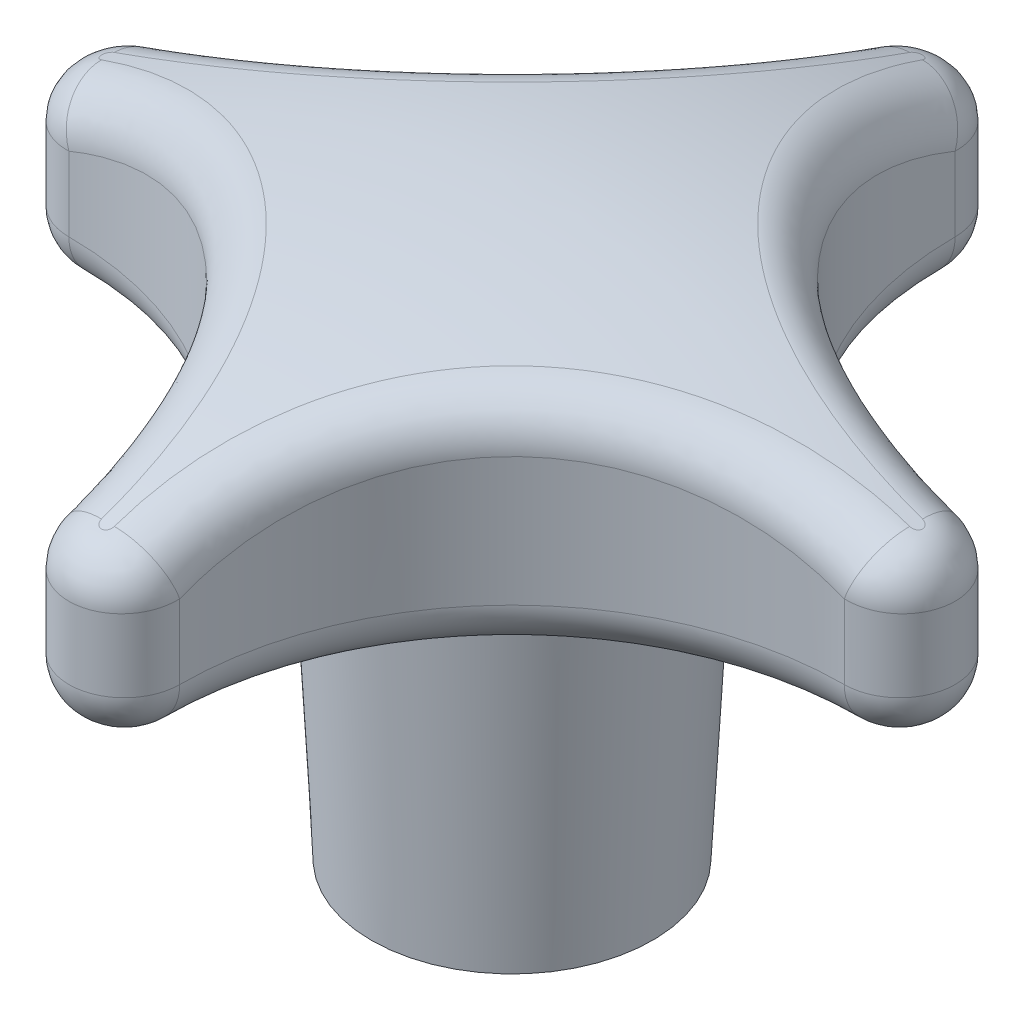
SolidWorks part; units mm, degrees
ref_plane "Front Plane" through (0, 0, 0) normal (0, 0, 1) x (1, 0, 0)
ref_plane "Top Plane" through (0, 0, 0) normal (0, 1, 0) x (1, 0, 0)
ref_plane "Right Plane" through (0, 0, 0) normal (1, 0, 0) x (0, 0, -1)
sketch "Sketch1" plane through (0, 0, 0) normal (0, 1, 0) x (1, 0, 0)
  circle A0 centre (0, 0) radius 10
  dimension "D1" = 20
extrude "Extrude1" add sketch "Sketch1" against normal blind 23
draft "Draft1" type of draft neutral plane draft angle 3 faces to draft 1 parameters "D1"=3
sketch "Sketch2" plane through (0, 0, 0) normal (0, 0, 1) x (1, 0, 0)
  line L0 (0, 0) -> (-31.5, 0)
  line L1 (-31.5, 0) -> (-31.5, 11.05)
  line L2 (0, 0) -> (0, 50000) construction
  line L3 (0, 17) -> (20.2547, 17) construction
  line L4 (0, 0) -> (0, 17)
  arc A0 (0, 17) -> (-31.5, 11.05) centre (0, -69.3574) ccw
revolve "Revolve1" add sketch "Sketch2" angle 360 about L2
sketch "Sketch4" plane through (0, 0, 0) normal (0, 1, 0) x (1, 0, 0)
  line L0 (0, 0) -> (-50000, 0) construction
  line L1 (0, 0) -> (0, 50000) construction
  line L2 (-27.5625, 3.9375) -> (-45.9117, 3.9375) construction
  line L3 (-3.9375, 27.5625) -> (-3.9375, 40.3224) construction
  arc A0 (0, 31.5) -> (-3.9375, 27.5625) centre (0, 27.5625) ccw
  arc A1 (-27.5625, 3.9375) -> (-31.5, 0) centre (-27.5625, 0) ccw
  circle A2 centre (0, 0) radius 31.5 construction
  arc A3 (-27.5625, 3.9375) -> (-3.9375, 27.5625) centre (-27.5625, 27.5625) ccw
  arc A4 (0, 31.5) -> (-31.5, 0) centre (-31.5, 31.5) ccw
  point P9 (0, 31.5)
  point P10 (-31.5, 0)
  point P13 (-3.9375, 27.5625)
  point P14 (-27.5625, 3.9375)
extrude "Extrude3" cut sketch "Sketch4" along normal through all
pattern_circular "CirPattern1" count 4 over 360 about axis through (0, 0, 0) along (0, 1, 0) of "Extrude3"
fillet "Fillet2" radius 3.5 16 edges at (0, 0, 31.5) (10.8571, 0, 10.8571) (31.5, 0, 0) (10.8571, 0, -10.8571) (0, 0, -31.5) (-10.8571, 0, -10.8571) (-31.5, 0, 0) (-0.0002, 11.05, 31.5) (13.307, 15.5215, 8.7232) (31.5, 11.05, 0.0002) (8.7232, 15.5215, -13.307) (0.0002, 11.05, -31.5) (-13.307, 15.5215, -8.7232) (-31.5, 11.05, 0.0002) (-10.8571, 0, 10.8571) (-8.7232, 15.5215, 13.307)
sketch "Sketch6" plane through (0, -23, 0) normal (0, -1, 0) x (1, 0, 0)
  circle A0 centre (0, 0) radius 6
  dimension "D1" = 12
extrude "Extrude5" [suppressed] cut sketch "Sketch6" against normal blind 25
sketch "Sketch7" [suppressed] plane through (0, 0, 0) normal (0, 0, 1) x (1, 0, 0)
  line L0 (-0.125, 1) -> (5, 1)
  line L1 (5, -20) -> (5, 1) construction
  line L2 (5, 1) -> (-0.125, 3.9589)
  line L3 (-0.125, 3.9589) -> (-0.125, 1)
  line L4 (-5, -20) -> (5, -20) construction
revolve "Cut-Revolve1" [suppressed] cut sketch "Sketch7" angle 360 about L3
sketch "Sketch10" plane through (0, -23, 0) normal (0, -1, 0) x (1, 0, 0)
  circle A0 centre (0, 0) radius 5.1
  dimension "D1" = 10.2
extrude "Extrude8" cut sketch "Sketch10" against normal blind 25
sketch "Sketch11" plane through (0, 0, 0) normal (0, 0, 1) x (1, 0, 0)
  line L0 (0, 2) -> (5.1, 2)
  line L1 (-5.1, 2) -> (5.1, 2) construction
  line L2 (5.1, 2) -> (0, 4.9445)
  line L3 (0, 4.9445) -> (0, 2)
  dimension "D1" = 30
revolve "Cut-Revolve2" cut sketch "Sketch11" angle 360 about L3
equation "\"D2@Sketch2\" = \"D1@Sketch2\"*.65"
equation "\"D1@Sketch4\" = (\"D3@Sketch2\"*2)/8"
equation "\"D2@Sketch4\" =( \"D3@Sketch2\"*2)/8"
equation "\"D1@Sketch7\" = \"D1@Extrude5\""
